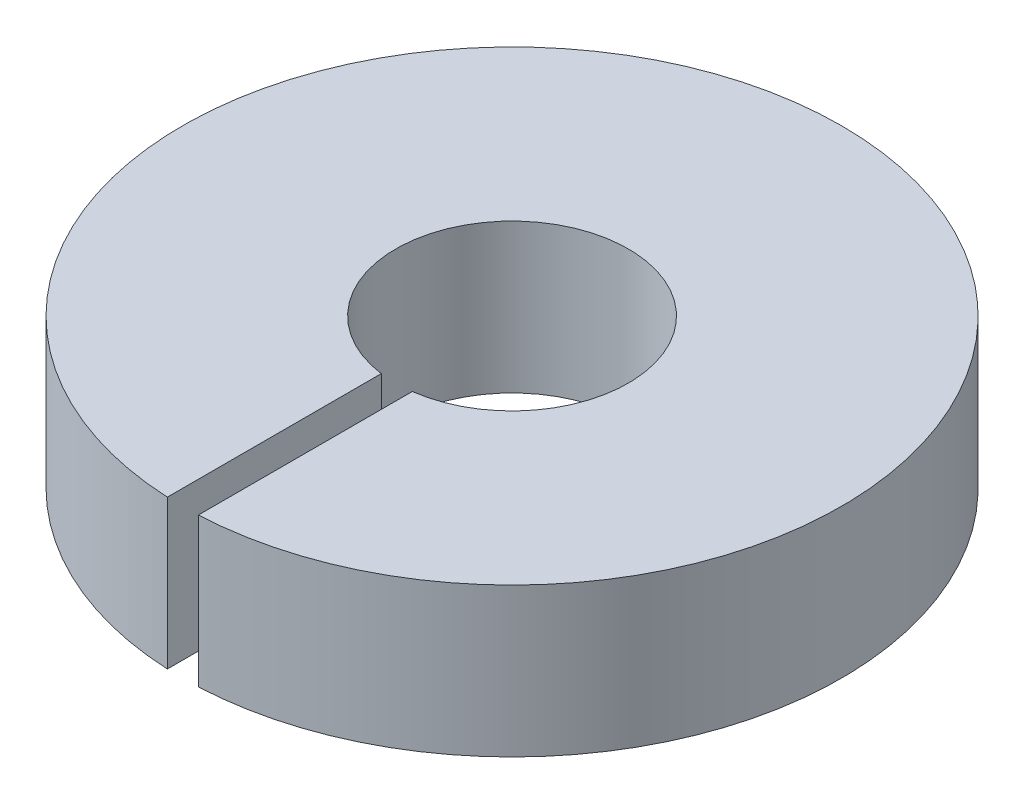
SolidWorks part; units mm, degrees
ref_plane "Front" through (0, 0, 0) normal (0, 0, 1) x (1, 0, 0)
ref_plane "Top" through (0, 0, 0) normal (0, 1, 0) x (1, 0, 0)
ref_plane "Right" through (0, 0, 0) normal (1, 0, 0) x (0, 0, -1)
sketch "Sketch1" plane through (0, 0, 0) normal (0, 1, 0) x (1, 0, 0)
  line L2 (-0.635, -4.72) -> (-0.635, -13.4788)
  line L4 (0.635, -4.72) -> (0.635, -13.4788)
  arc A0 (0.635, -4.72) -> (-0.635, -4.72) centre (0, 0) ccw
  arc A1 (0.635, -13.4788) -> (-0.635, -13.4788) centre (0, 0) ccw
  dimension "D1" = 26.9875
  dimension "D2" = 9.525
  dimension "D3" = 1.27
  dimension "D4" = 0.635
extrude "Base-Extrude" add sketch "Sketch1" along normal blind 6.096
sketch "Sketch2" plane through (0, 0, 0) normal (1, 0, 0) x (0, 0, -1)
  line L0 (0, 9.0249) -> (0, -1.6042) construction
  line L1 (0, 6.096) -> (0, 0) construction
  line L2 (-13.4788, 3.048) -> (0.46, 3.048) construction
  line L3 (-13.4788, 6.096) -> (-13.4788, 0) construction
  circle A0 centre (-6.35, 3.048) radius 1.1303
  dimension "D1" = 2.2606
  dimension "D2" = 6.35
extrude "Cut-Extrude1" cut sketch "Sketch2" against normal mid plane 19.05
ref_plane "Plane1" through (3.175, 0, 0) normal (-1, 0, 0) x (0, 0, 1)
sketch "Sketch3" plane through (3.175, 0, 0) normal (-1, 0, 0) x (0, 0, 1)
  circle A0 centre (6.35, 3.048) radius 2.3813
  dimension "D1" = 4.7625
extrude "Cut-Extrude2" cut sketch "Sketch3" against normal blind 6.858
